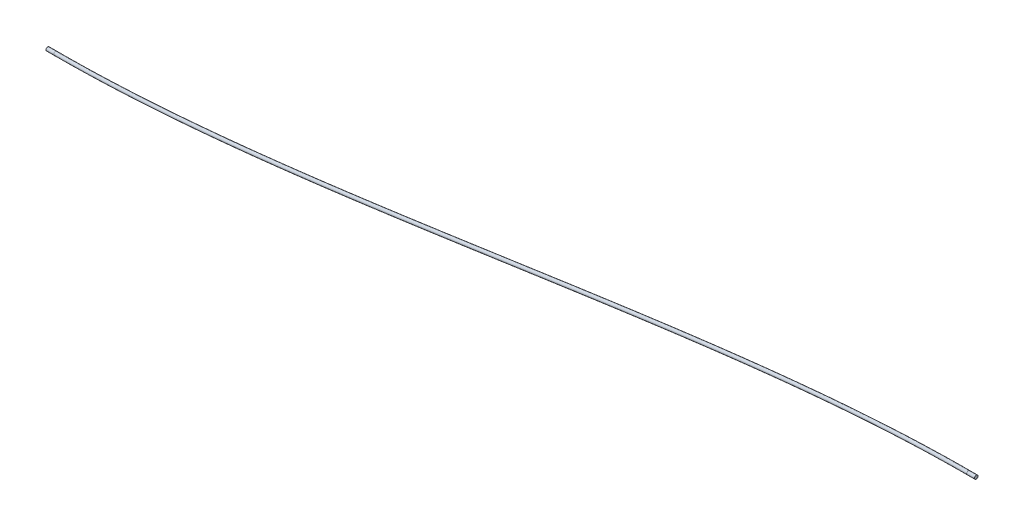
SolidWorks part; units mm, degrees
ref_plane "Front Plane" through (0, 0, 0) normal (0, 0, 1) x (1, 0, 0)
ref_plane "Top Plane" through (0, 0, 0) normal (0, 1, 0) x (1, 0, 0)
ref_plane "Right Plane" through (0, 0, 0) normal (1, 0, 0) x (0, 0, -1)
sketch3d "3DSketch1"
  line L0 (-365.887, 65.8188, -30.388) -> (-358.887, 65.8188, -30.388) construction
  line L1 (365.887, 44.45, -135.9) -> (358.887, 44.45, -135.9) construction
  line L2 (-365.887, 65.8188, -30.388) -> (-358.887, 65.8188, -30.388)
  line L3 (365.887, 44.45, -135.9) -> (358.887, 44.45, -135.9)
  spline S0 degree 3 poles (1577.9146, 343.268, 1339.5624) (345.4549, -319.3812, -1932.3754) (-345.4471, 429.6475, 1766.0751) (-1577.9036, -232.9933, -1505.8211) knots -1.521262 -1.521262 -1.521262 -1.521262 2.52125 2.52125 2.52125 2.52125 only from (358.887, 44.45, -135.9) to (-358.887, 65.8188, -30.388) construction
  spline S1 degree 3 poles (358.887, 44.45, -135.9) (116.8964, 44.45, -135.9) (-116.8964, 65.8188, -30.388) (-358.887, 65.8188, -30.388) knots 0 0 0 0 1 1 1 1
ref_plane "Plane1" through (-365.887, 65.8188, -30.388) normal (1, 0, 0) x (0, 0, -1)
sketch "PipeSketch" plane through (-365.887, 65.8188, -30.388) normal (1, 0, 0) x (0, 0, -1)
  circle A0 centre (0, 0) radius 1.5875
  dimension "OuterDiameter" = 3.175
sweep "Cable_1" add profiles "PipeSketch" path "3DSketch1"
